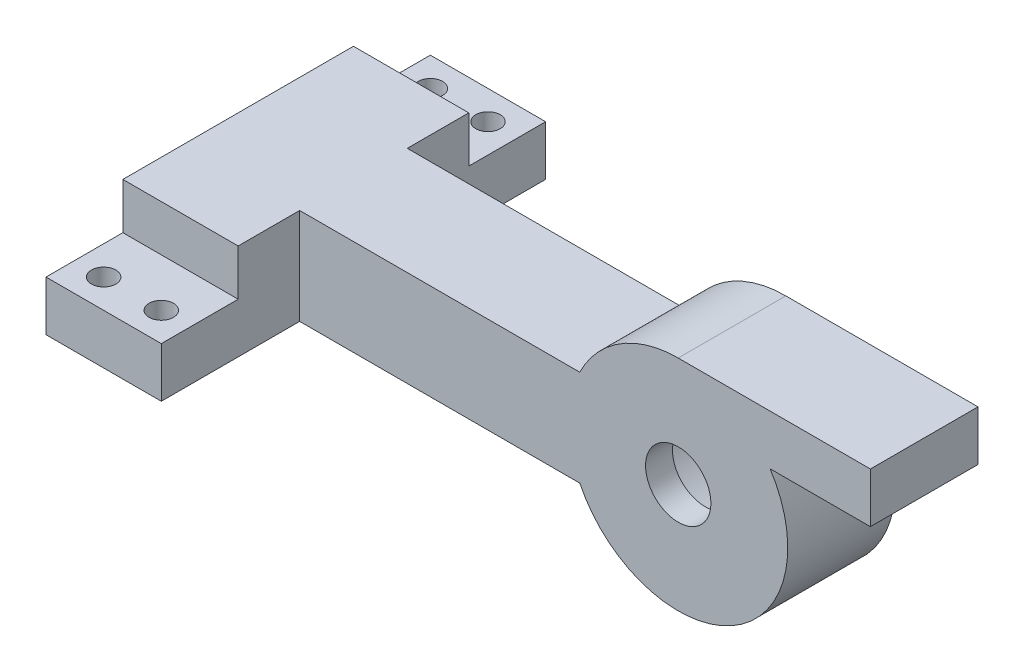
SolidWorks part; units mm, degrees
ref_plane "Front Plane" through (0, 0, 0) normal (0, 0, 1) x (1, 0, 0)
ref_plane "Top Plane" through (0, 0, 0) normal (0, 1, 0) x (1, 0, 0)
ref_plane "Right Plane" through (0, 0, 0) normal (1, 0, 0) x (0, 0, -1)
sketch "Sketch2" plane through (0, 0, 0) normal (0, 0, 1) x (1, 0, 0)
  line L0 (100, 12.5) -> (128.5, 12.5) construction
  line L1 (0, 0) -> (100, 0)
  line L2 (0, 0) -> (0, 25)
  line L3 (0, 25) -> (100, 25)
  line L5 (100, 0) -> (102.8875, 0)
  line L6 (100, 25) -> (102.8875, 25)
  line L7 (100, 25) -> (100, 0) construction
  circle A0 centre (128.5, 12.5) radius 23.5
  arc A1 (102.8875, 0) -> (102.8875, 25) centre (128.5, 12.5) ccw
  point P8 (100, 12.5)
  dimension "D3" = 47
  dimension "D4" = 5
  dimension "D5" = 12.8292
  dimension "D1" = 100
  dimension "D2" = 25
extrude "Boss-Extrude4" add sketch "Sketch2" along normal mid plane 28
sketch "Sketch5" plane through (0, 0, 14) normal (0, 0, 1) x (1, 0, 0)
  circle A0 centre (128.5, 12.5) radius 23.5
  circle A1 centre (128.5, 12.5) radius 8.5
  circle A2 centre (128.5, 12.5) radius 23.5 construction
  dimension "D1" = 17
extrude "Boss-Extrude5" add sketch "Sketch5" against normal blind 7 separate body
sketch "Sketch8" plane through (0, 0, 0) normal (0, 0, 1) x (1, 0, 0)
  line L0 (102.8875, 25) -> (0, 25) construction
  line L1 (0, 0) -> (30, 0)
  line L2 (0, 0) -> (0, 25)
  line L3 (0, 25) -> (30, 25)
  line L4 (30, 0) -> (30, 25)
  dimension "D1" = 30
extrude "Boss-Extrude6" add sketch "Sketch8" along normal mid plane 100
sketch "Sketch9" plane through (30, 0, 0) normal (1, 0, 0) x (0, 0, -1)
  line L0 (14, 25) -> (50, 25) construction
  line L1 (30, 13) -> (50, 13)
  line L2 (30, 13) -> (30, 25)
  line L3 (30, 25) -> (50, 25)
  line L4 (50, 13) -> (50, 25)
  line L5 (50, 0) -> (50, 25) construction
  line L6 (-50, 25) -> (-30, 25)
  line L7 (-50, 25) -> (-50, 13)
  line L8 (-50, 13) -> (-30, 13)
  line L9 (-30, 25) -> (-30, 13)
  dimension "D1" = 20
  dimension "D2" = 12
  dimension "D3" = 12
  dimension "D4" = 20
extrude "Cut-Extrude1" cut sketch "Sketch9" against normal through all both and the other way through all
sketch "Sketch10" plane through (0, 13, 0) normal (0, 1, 0) x (1, 0, 0)
  line L0 (22.5, 50) -> (22.5, 42.5) construction
  line L1 (0, 50) -> (30, 50) construction
  line L2 (22.5, 42.5) -> (30, 42.5) construction
  line L3 (30, 50) -> (30, 30) construction
  line L4 (7.5, 50) -> (7.5, 42.5) construction
  line L5 (7.5, 42.5) -> (0, 42.5) construction
  line L6 (0, 30) -> (0, 50) construction
  line L7 (7.5, -50) -> (7.5, -42.5) construction
  line L8 (0, -50) -> (30, -50) construction
  line L9 (7.5, -42.5) -> (0, -42.5) construction
  line L10 (0, -50) -> (0, -30) construction
  line L11 (22.5, -50) -> (22.5, -42.5) construction
  line L12 (22.5, -42.5) -> (30, -42.5) construction
  line L13 (30, -30) -> (30, -50) construction
  circle A0 centre (7.5, 42.5) radius 3.175
  circle A1 centre (22.5, 42.5) radius 3.175
  circle A2 centre (22.5, -42.5) radius 3.175
  circle A3 centre (7.5, -42.5) radius 3.175
  dimension "D1" = 6.35
  dimension "D2" = 7.5
extrude "Cut-Extrude2" cut sketch "Sketch10" against normal through all
sketch "Sketch12" plane through (0, 0, 14) normal (0, 0, 1) x (1, 0, 0)
  line L2 (152.4165, 28) -> (178.5, 28)
  line L3 (178.5, 28) -> (178.5, 41)
  line L4 (178.5, 41) -> (128.5, 41)
  circle A5 centre (128.5, 12.5) radius 15.5
  circle A6 centre (128.5, 12.5) radius 8.5 construction
  arc A7 (102.8875, 0) -> (102.8875, 25) centre (128.5, 12.5) ccw construction
  arc A8 (152.4165, 28) -> (128.5, 41) centre (128.5, 12.5) ccw
  point P0 (128.5, 28)
  point P4 (175.6671, 42.4676)
  point P9 (128.5, 41)
  point P13 (0, 0)
  point P14 (132.5436, 40.7117)
  point P15 (0, 0)
  dimension "D1" = 31
  dimension "D2" = 28.5
  dimension "D3" = 50
extrude "Boss-Extrude8" add sketch "Sketch12" against normal up to surface (28 mm away)
